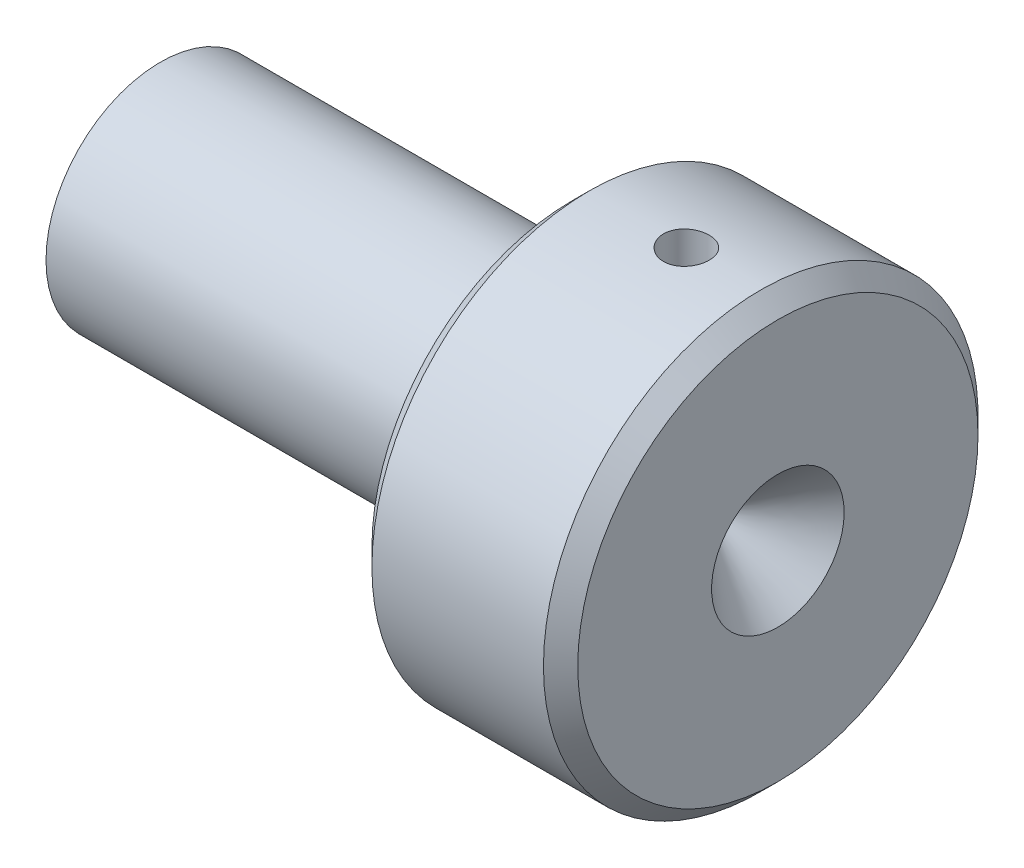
SolidWorks part; units mm, degrees
ref_plane "Plan de face" through (0, 0, 0) normal (0, 0, 1) x (1, 0, 0)
ref_plane "Plan de dessus" through (0, 0, 0) normal (0, 1, 0) x (1, 0, 0)
ref_plane "Plan de droite" through (0, 0, 0) normal (1, 0, 0) x (0, 0, -1)
sketch "Esquisse1" plane through (0, 0, 0) normal (0, 0, 1) x (1, 0, 0)
  line L0 (0, 19) -> (0, 1)
  line L1 (0, 19) -> (-18, 19)
  line L2 (-18, 19) -> (-18, 10)
  line L3 (-18, 10) -> (-54, 10)
  line L4 (-54, 10) -> (-54, 3.3577)
  line L5 (-54, 3.3577) -> (0, 1)
  line L6 (-77.2951, 0) -> (21.2017, 0) construction
  dimension "D1" = 38
  dimension "D2" = 18
  dimension "D3" = 18
  dimension "D4" = 20
  dimension "D5" = 2.5
  dimension "D6" = 36
  dimension "D7" = 1
revolve "Révolution1" add sketch "Esquisse1" angle 360 about L6
chamfer "Chanfrein1" distance 1.5 angle 45 2 edges at (0, 0, 19) (-18, 0, 19)
chamfer "Chanfrein2" distance 5 angle 45 1 edges at (0, 0, 1)
ref_plane "Plan1" through (0, 19, 0) normal (0, 1, 0) x (-1, 0, 0)
sketch "Esquisse4" plane through (0, 19, 0) normal (0, 1, 0) x (-1, 0, 0)
  line L1 (-4.5534, 0) -> (24.5766, 0) construction
hole_wizard "Diamètre du perçage Ø4.0 (4)2" positions "Esquisse8" profile "Esquisse7" hole size "Ø4.0" standard "ISO"
sketch "Esquisse8" plane through (0, 19, 0) normal (0, 1, 0) x (-1, 0, 0)
  line L0 (18, -17.5) -> (18, 17.5) construction
  point P0 (8, 0)
  dimension "D1" = 10
sketch "Esquisse7" plane through (-8, 19, 0) normal (1, 0, 0) x (0, 0, 1)
  line L0 (0, 0) -> (0, 7.2017)
  line L1 (0, 7.2017) -> (2, 6)
  line L2 (2, 6) -> (2, 0)
  line L5 (2, 0) -> (0, 0)
  line L10 (0, 7.2017) -> (-2, 6) construction
  line L11 (0, -6.35) -> (0, 107.95) construction
  dimension "Diamètre du perçage" = 4
  dimension "Profondeur du perçage" = 6
  dimension "Angle de pointe" = 118
